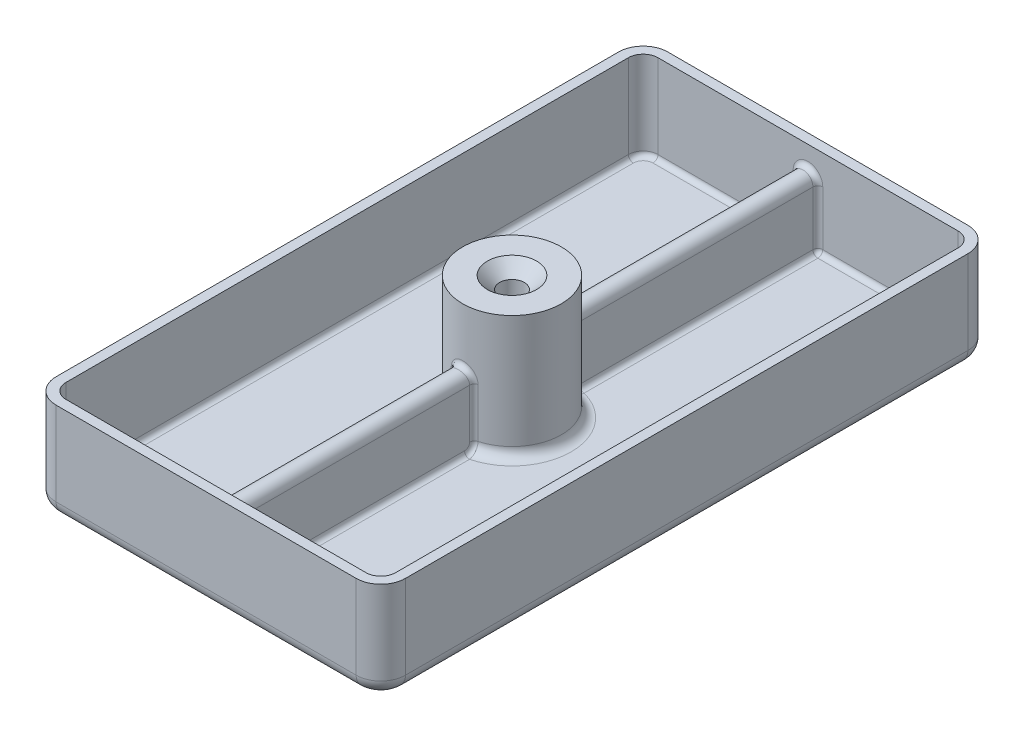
SolidWorks part; units mm, degrees
ref_plane "Front" through (0, 0, 0) normal (0, 0, 1) x (1, 0, 0)
ref_plane "Top" through (0, 0, 0) normal (0, 1, 0) x (1, 0, 0)
ref_plane "Right" through (0, 0, 0) normal (1, 0, 0) x (0, 0, -1)
sketch "Sketch1" plane through (0, 0, 0) normal (0, 1, 0) x (1, 0, 0)
  line L0 (-35.4102, -62.0052) -> (35.4102, -62.0052)
  line L1 (-35.4102, -62.0052) -> (-35.4102, 62.0052)
  line L2 (35.4102, 62.0052) -> (-35.4102, 62.0052)
  line L3 (35.4102, 62.0052) -> (35.4102, -62.0052)
  line L4 (-35.4102, 62.0052) -> (35.4102, -62.0052) construction
  point P5 (0, 0)
  dimension "D1" = 124.0104
  dimension "D2" = 70.8205
extrude "Base-Extrude" add sketch "Sketch1" along normal blind 20
fillet "Fillet1" radius 5 4 edges at (-35.4102, 10, 62.0052) (35.4102, 10, 62.0052) (35.4102, 10, -62.0052) (-35.4102, 10, -62.0052)
fillet "Fillet2" radius 3 8 edges at (-35.4102, 0, 0) (0, 0, -62.0052) (35.4102, 0, 0) (0, 0, 62.0052) (33.9458, 0, -60.5407) (33.9458, 0, 60.5407) (-33.9458, 0, 60.5407) (-33.9458, 0, -60.5407)
shell "Shell1" thickness 2
sketch "Sketch2" plane through (0, 0, 0) normal (0, 0, 1) x (1, 0, 0)
  line L0 (0, 0) -> (0, 23.9525) construction
  line L1 (-2, 2) -> (-2, 14)
  line L2 (30.4102, 2) -> (-30.4102, 2) construction
  line L3 (2, 14) -> (2, 2)
  line L4 (2, 2) -> (-2, 2)
  arc A0 (-2, 14) -> (2, 14) centre (0, 14) cw
  dimension "D1" = 2
  dimension "D2" = 12
extrude "Rib" add sketch "Sketch2" along normal up to next and the other way up to next
sketch "Sketch3" plane through (0, 2, 0) normal (0, 1, 0) x (-1, 0, 0)
  circle A0 centre (0, 0) radius 10
  dimension "D1" = 20
extrude "CylBoss" add sketch "Sketch3" along normal blind 25
fillet "Fillet4" radius 2 2 edges at (10, 2, 0) (-10, 2, 0)
fillet "Fillet5" radius 1 24 edges at (-2, 8.5, -60.0052) (-2, 2.2929, 59.7123) (0, 16, -60.0052) (2, 2.2929, 59.7123) (2, 2, 35.4187) (2, 8.5, -60.0052) (-2, 2, 35.4187) (2, 8.5, 60.0052) (0, 16, 60.0052) (-2, 8.5, 60.0052) (-2, 2.2929, -59.7123) (2, 2.2929, -59.7123) (2, 9, -9.798) (-0.455, 12.0524, 9.9896) (-2, 9, 9.798) (-0.455, 15.9476, -9.9896) (2, 9, 9.798) (-2, 9, -9.798) (2, 2, -35.4187) (2, 2.7686, -10.2304) (2, 2.4508, 10.5472) (-2, 2.7686, 10.2304) (-2, 2, -35.4187) (-2, 2.4508, -10.5472)
hole_wizard "CounterSnk" positions "Sketch4" profile "Sketch5" legacy
sketch "Sketch4" plane through (0, 27, 0) normal (0, 1, 0) x (-1, 0, 0)
  point P0 (0, 0)
sketch "Sketch5" plane through (0, 27, 0) normal (1, 0, 0) x (0, 0, 1)
  line L0 (0, 0) -> (0, 27)
  line L1 (0, 27) -> (2.5, 27)
  line L2 (2.5, 27) -> (2.5, 2.5)
  line L3 (2.5, 2.5) -> (5, 0)
  line L4 (5, 0) -> (0, 0)
  line L5 (0, 116.4889) -> (0, 0) construction
